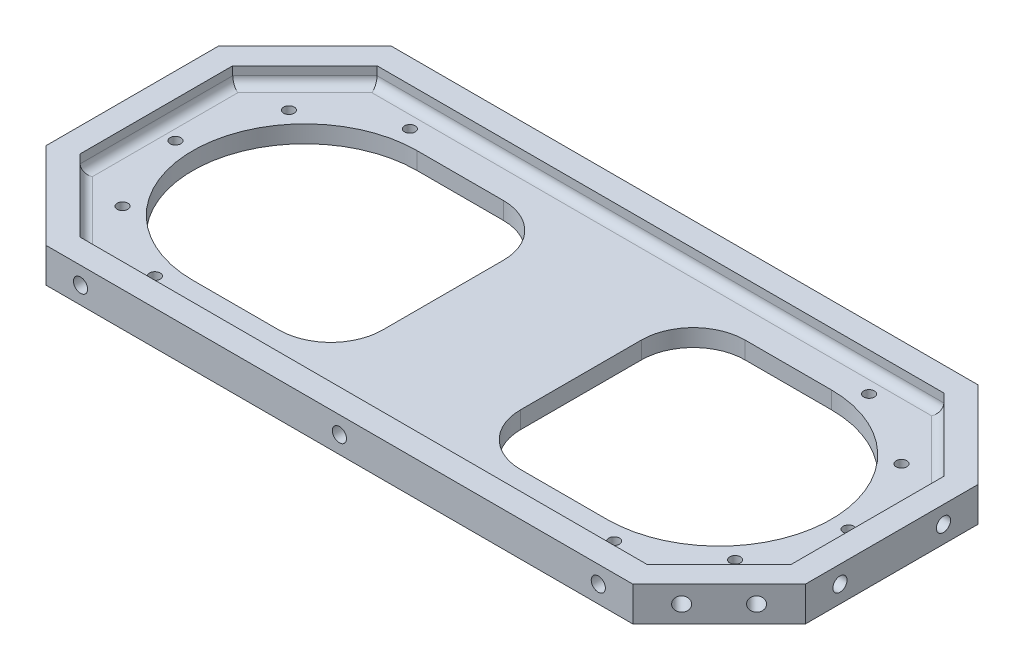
SolidWorks part; units mm, degrees
ref_plane "Front Plane" through (0, 0, 0) normal (0, 0, 1) x (1, 0, 0)
ref_plane "Top Plane" through (0, 0, 0) normal (0, 1, 0) x (1, 0, 0)
ref_plane "Right Plane" through (0, 0, 0) normal (1, 0, 0) x (0, 0, -1)
sketch "Sketch1" plane through (0, 0, 0) normal (0, 1, 0) x (1, 0, 0)
  line L1 (0, 0) -> (60, 0) construction
  line L3 (60, -75) -> (0, -75) construction
  line L7 (0, 12.5) -> (0, 0)
  line L9 (0, -75) -> (0, -87.5)
  line L10 (0, -115.7193) -> (0, -87.5) construction
  line L11 (0, -75) -> (0, 0)
  line L12 (0, 12.5) -> (85, 12.5)
  line L14 (85, 12.5) -> (110, -12.5)
  line L15 (110, -12.5) -> (110, -62.5)
  line L16 (110, -62.5) -> (85, -87.5)
  line L17 (0, -87.5) -> (85, -87.5)
  line L18 (60, -5) -> (20, -5)
  line L19 (60, -70) -> (20, -70)
  line L20 (20, -5) -> (20, -70)
  arc A0 (60, 0) -> (60, -75) centre (60, -37.5) cw construction
  arc A4 (60, -70) -> (60, -5) centre (60, -37.5) ccw
extrude "Main" add sketch "Sketch1" along normal blind 10
sketch "Sketch3" plane through (0, 10, 0) normal (0, 1, 0) x (1, 0, 0)
  arc A0 (60, -75) -> (60, 0) centre (60, -37.5) ccw construction
  arc A1 (60, -75) -> (60, 0) centre (60, -37.5) ccw construction
  circle A2 centre (97.5, -37.5) radius 1.55
  dimension "D1" = 3.1
extrude "Actuator Screw Hole" cut sketch "Sketch3" against normal through all
pattern_circular "Actuator Screw Hole Pattern" count 3 every 40 about axis through (60, 0, 37.5) along (0, 1, 0) of "Actuator Screw Hole"
fillet "Midspan fillet" radius 15 2 edges at (20, 5, 5) (20, 5, 70)
mirror "Mirror1" about plane through (0, 0, 0) normal (1, 0, 0)
sketch "Sketch7" plane through (0, 10, 0) normal (0, 1, 0) x (1, 0, 0)
  line L0 (0, -6.5) -> (0, -37.5) construction
  line L1 (110, -37.5) -> (-110, -37.5) construction
  line L2 (110, -12.5) -> (110, -62.5) construction
  line L3 (-85, 12.5) -> (85, 12.5) construction
  line L4 (-110, -12.5) -> (-110, -62.5) construction
  line L5 (0, -37.5) -> (0, -68.5) construction
  circle A0 centre (0, -68.5) radius 12
  circle A1 centre (0, -6.5) radius 12
  dimension "D1" = 24
  dimension "D2" = 7
extrude "Wire holes" [suppressed] cut sketch "Sketch7" against normal through all
sketch "Sketch8" plane through (0, 10, 0) normal (0, 1, 0) x (1, 0, 0)
  line L16 (82.1005, 5.5) -> (-82.1005, 5.5)
  line L17 (-82.1005, 5.5) -> (-103, -15.3995)
  line L18 (-103, -15.3995) -> (-103, -59.6005)
  line L19 (-103, -59.6005) -> (-82.1005, -80.5)
  line L20 (-82.1005, -80.5) -> (82.1005, -80.5)
  line L21 (82.1005, -80.5) -> (103, -59.6005)
  line L22 (103, -59.6005) -> (103, -15.3995)
  line L23 (103, -15.3995) -> (82.1005, 5.5)
  line L24 (82.1005, 5.5) -> (-82.1005, 5.5)
  line L25 (-82.1005, 5.5) -> (-103, -15.3995)
  line L26 (-103, -15.3995) -> (-103, -59.6005)
  line L27 (-103, -59.6005) -> (-82.1005, -80.5)
  line L28 (-82.1005, -80.5) -> (82.1005, -80.5)
  line L29 (82.1005, -80.5) -> (103, -59.6005)
  line L30 (103, -59.6005) -> (103, -15.3995)
  line L31 (103, -15.3995) -> (82.1005, 5.5)
  dimension "D1" = 7
extrude "Dish" cut sketch "Sketch8" against normal blind 5
fillet "Dish fillet" radius 2.5 8 edges at (0, 5, 80.5) (0, 5, -5.5) (92.5503, 5, 4.9497) (103, 5, 37.5) (92.5503, 5, 70.0503) (-92.5503, 5, 70.0503) (-103, 5, 37.5) (-92.5503, 5, 4.9497)
chamfer "Wire hole chamfer" [suppressed] distance 1 angle 45
sketch3d "3DSketch2"
  line L0 (-85, 5, 87.5) -> (-75, 5, 87.5) construction
  line L1 (-85, 10, 87.5) -> (-85, 0, 87.5) construction
  line L2 (-75, 5, 87.5) -> (0, 5, 87.5) construction
  line L3 (0, 5, 87.5) -> (75, 5, 87.5) construction
  line L4 (75, 5, 87.5) -> (85, 5, 87.5) construction
  line L5 (85, 10, 87.5) -> (85, 0, 87.5) construction
  line L6 (85, 5, 87.5) -> (92.0711, 5, 80.4289) construction
  line L7 (92.0711, 5, 80.4289) -> (102.9289, 5, 69.5711) construction
  line L8 (102.9289, 5, 69.5711) -> (110, 5, 62.5) construction
  line L9 (110, 10, 62.5) -> (110, 0, 62.5) construction
  line L10 (110, 5, 62.5) -> (110, 5, 52.5) construction
  line L11 (110, 5, 52.5) -> (110, 5, 22.5) construction
  line L12 (110, 5, 22.5) -> (110, 5, 12.5) construction
  line L13 (110, 10, 12.5) -> (110, 0, 12.5) construction
  line L14 (110, 5, 12.5) -> (102.9289, 5, 5.4289) construction
  line L15 (102.9289, 5, 5.4289) -> (92.0711, 5, -5.4289) construction
  line L16 (92.0711, 5, -5.4289) -> (85, 5, -12.5) construction
  line L17 (85, 10, -12.5) -> (85, 0, -12.5) construction
  line L18 (85, 5, -12.5) -> (75, 5, -12.5) construction
  line L19 (75, 5, -12.5) -> (0, 5, -12.5) construction
  line L20 (-75, 5, -12.5) -> (-85, 5, -12.5) construction
  line L21 (-85, 10, -12.5) -> (-85, 0, -12.5) construction
  line L22 (-85, 5, -12.5) -> (-92.0711, 5, -5.4289) construction
  line L23 (-92.0711, 5, -5.4289) -> (-102.9289, 5, 5.4289) construction
  line L24 (-102.9289, 5, 5.4289) -> (-110, 5, 12.5) construction
  line L25 (-110, 10, 12.5) -> (-110, 0, 12.5) construction
  line L26 (-110, 5, 12.5) -> (-110, 5, 22.5) construction
  line L27 (-110, 5, 22.5) -> (-110, 5, 52.5) construction
  line L28 (-110, 5, 52.5) -> (-110, 5, 62.5) construction
  line L29 (-110, 10, 62.5) -> (-110, 0, 62.5) construction
  line L30 (-110, 5, 62.5) -> (-102.9289, 5, 69.5711) construction
  line L31 (-102.9289, 5, 69.5711) -> (-92.0711, 5, 80.4289) construction
  line L32 (-92.0711, 5, 80.4289) -> (-85, 5, 87.5) construction
  line L33 (0, 5, -12.5) -> (-75, 5, -12.5) construction
  dimension "D1" = 10
  dimension "D2" = 10
  dimension "D3" = 10
hole_wizard "Ø4.0mm Dowel Hole1" positions "3DSketch5" profile "Sketch12" hole size "Ø4.0" standard "ANSI Metric"
sketch3d "3DSketch5"
  line L0 (85, 5, -12.5) -> (75, 5, -12.5) construction
  line L1 (85, 10, -12.5) -> (85, 0, -12.5) construction
  line L2 (75, 5, -12.5) -> (0, 5, -12.5) construction
  line L3 (0, 5, -12.5) -> (-75, 5, -12.5) construction
  line L4 (-75, 5, -12.5) -> (-85, 5, -12.5) construction
  line L5 (-85, 10, -12.5) -> (-85, 0, -12.5) construction
  line L6 (-85, 5, -12.5) -> (-92.0711, 5, -5.4289) construction
  line L7 (-92.0711, 5, -5.4289) -> (-102.9289, 5, 5.4289) construction
  line L8 (-102.9289, 5, 5.4289) -> (-110, 5, 12.5) construction
  line L9 (-110, 10, 12.5) -> (-110, 0, 12.5) construction
  line L10 (-110, 5, 12.5) -> (-110, 5, 22.5) construction
  line L11 (-110, 5, 22.5) -> (-110, 5, 52.5) construction
  line L12 (-110, 5, 52.5) -> (-110, 5, 62.5) construction
  line L13 (-110, 10, 62.5) -> (-110, 0, 62.5) construction
  line L14 (-110, 5, 62.5) -> (-102.9289, 5, 69.5711) construction
  line L15 (-102.9289, 5, 69.5711) -> (-92.0711, 5, 80.4289) construction
  line L16 (-92.0711, 5, 80.4289) -> (-85, 5, 87.5) construction
  line L17 (-85, 10, 87.5) -> (-85, 0, 87.5) construction
  line L18 (-85, 5, 87.5) -> (-75, 5, 87.5) construction
  line L19 (-75, 5, 87.5) -> (0, 5, 87.5) construction
  line L20 (0, 5, 87.5) -> (75, 5, 87.5) construction
  line L21 (75, 5, 87.5) -> (85, 5, 87.5) construction
  line L22 (85, 10, 87.5) -> (85, 0, 87.5) construction
  line L23 (85, 5, 87.5) -> (92.0711, 5, 80.4289) construction
  line L24 (92.0711, 5, 80.4289) -> (102.9289, 5, 69.5711) construction
  line L25 (102.9289, 5, 69.5711) -> (110, 5, 62.5) construction
  line L26 (110, 10, 62.5) -> (110, 0, 62.5) construction
  line L27 (110, 5, 62.5) -> (110, 5, 52.5) construction
  line L28 (110, 5, 52.5) -> (110, 5, 22.5) construction
  line L29 (110, 5, 22.5) -> (110, 5, 12.5) construction
  line L30 (110, 10, 12.5) -> (110, 0, 12.5) construction
  line L31 (110, 5, 12.5) -> (102.9289, 5, 5.4289) construction
  line L32 (102.9289, 5, 5.4289) -> (92.0711, 5, -5.4289) construction
  line L33 (92.0711, 5, -5.4289) -> (85, 5, -12.5) construction
  line L34 (110, 5, 12.5) -> (85, 5, -12.5) construction
  line L36 (-85, 5, -12.5) -> (-110, 5, 12.5) construction
  line L38 (-110, 5, 62.5) -> (-85, 5, 87.5) construction
  line L40 (85, 5, 87.5) -> (110, 5, 62.5) construction
  point P0 (75, 5, -12.5)
  point P2 (0, 5, -12.5)
  point P4 (-75, 5, -12.5)
  point P6 (-92.0711, 5, -5.4289)
  point P8 (-102.9289, 5, 5.4289)
  point P10 (-110, 5, 22.5)
  point P12 (-110, 5, 52.5)
  point P14 (-102.9289, 5, 69.5711)
  point P16 (-92.0711, 5, 80.4289)
  point P18 (-75, 5, 87.5)
  point P20 (0, 5, 87.5)
  point P22 (75, 5, 87.5)
  point P24 (92.0711, 5, 80.4289)
  point P26 (102.9289, 5, 69.5711)
  point P28 (110, 5, 52.5)
  point P30 (110, 5, 22.5)
  point P32 (102.9289, 5, 5.4289)
  point P34 (92.0711, 5, -5.4289)
  dimension "D1" = 10
  dimension "D2" = 10
  dimension "D3" = 10
sketch "Sketch12" plane through (75, 5, -12.5) normal (1, 0, 0) x (0, 1, 0)
  line L0 (0, 0) -> (0, 5.7)
  line L1 (0, 5.7) -> (2.05, 5.7)
  line L2 (2.05, 5.7) -> (2.05, 0)
  line L5 (2.05, 0) -> (0, 0)
  line L10 (0, 5.7) -> (-2.05, 5.7) construction
  line L11 (0, -6.35) -> (0, 107.95) construction
  dimension "Hole Dia." = 4.1
  dimension "Hole Depth" = 5.7
  dimension "Drill Angle" = 180
equation "\"length\" = 215mm"
equation "\"width\" = 220mm"
equation "\"height\" = 100mm"
equation "\"skin_th\" = 8mm"
equation "\"D6@Sketch1\"=\"width\""
equation "\"D8@Sketch1\"=\"height\""
